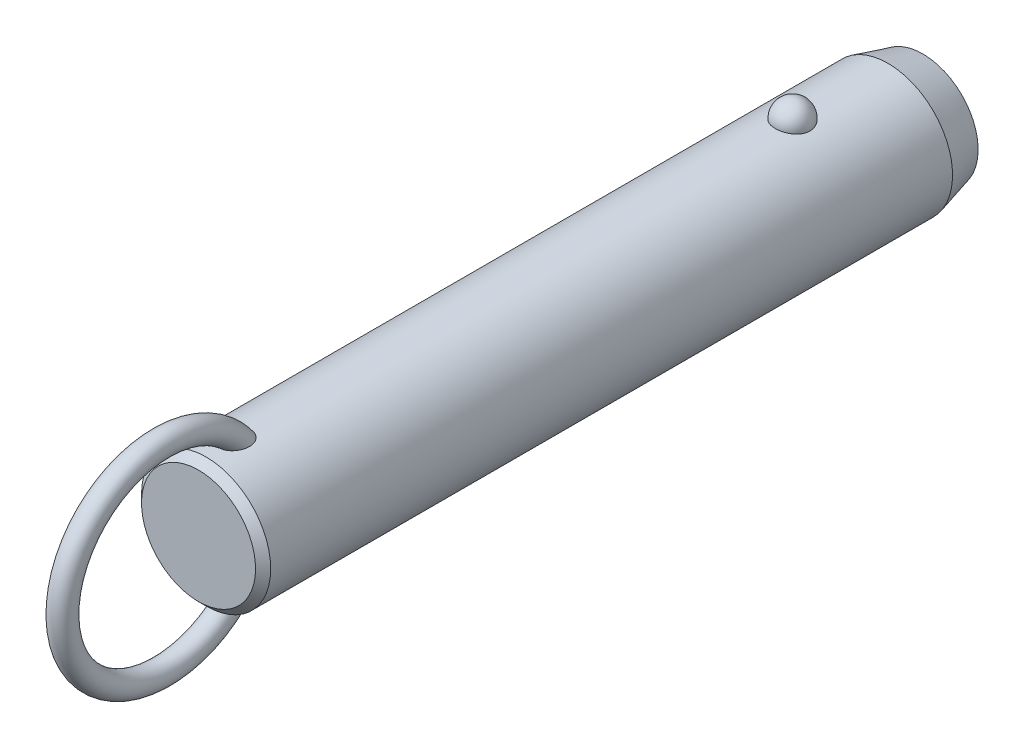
SolidWorks part; units mm, degrees
ref_plane "Front Plane" through (0, 0, 0) normal (0, 0, 1) x (1, 0, 0)
ref_plane "Top Plane" through (0, 0, 0) normal (0, 1, 0) x (1, 0, 0)
ref_plane "Right Plane" through (0, 0, 0) normal (1, 0, 0) x (0, 0, -1)
sketch "Sketch2" plane through (0, 0, 0) normal (0, 0, 1) x (1, 0, 0)
  circle A0 centre (0, 0) radius 11.1
  point P3 (0, 11.1)
  dimension "D1" = 22.2
extrude "Boss-Extrude1" add sketch "Sketch2" along normal blind 86.4
sketch "Sketch3" plane through (0, 0, 0) normal (0, 0, -1) x (-1, 0, 0)
  circle A0 centre (0, 0) radius 11.1
  dimension "D1" = 22.2
extrude "Boss-Extrude2" add sketch "Sketch3" along normal blind 25.4
chamfer "Chamfer1" distance 6 angle 15 1 edges at (-11.1, 0, -25.4)
sketch "Sketch12" plane through (0, 0, 0) normal (1, 0, 0) x (0, 0, -1)
  line L0 (-86.4, 11.1) -> (-86.4, -11.1) construction
  point P0 (-86.4, 0)
sketch "Sketch13" plane through (0, 0, 0) normal (1, 0, 0) x (0, 0, -1)
  circle A0 centre (-105.45, 0) radius 19.05
  point P2 (-86.4, 0)
  dimension "D1" = 38.1
sketch "Sketch14" plane through (0, 0, 0) normal (0, 1, 0) x (1, 0, 0)
  circle A0 centre (0, -88.4) radius 2
  point P2 (0, -86.4)
  dimension "D1" = 4
sweep "Sweep1" add profiles "Sketch14" path "Sketch13"
sketch "Sketch15" plane through (0, 0, 86.4) normal (0, 0, 1) x (1, 0, 0)
  circle A0 centre (0, 0) radius 11.1
  dimension "D1" = 22.2
extrude "Boss-Extrude3" add sketch "Sketch15" along normal blind 12.7
chamfer "Chamfer2" distance 1.3 angle 45 1 edges at (11.1, 0, 99.1)
sketch "Sketch18" plane through (0, 0, 0) normal (1, 0, 0) x (0, 0, -1)
  line L0 (19.4, 11.1) -> (-89.968, 11.1) construction
  line L1 (3, 14.1) -> (3, 8.1)
  line L2 (-89.968, -11.1) -> (19.4, -11.1) construction
  arc A0 (3, 14.1) -> (3, 8.1) centre (3, 11.1) ccw
  point P4 (0, 11.1)
  dimension "D1" = 25.2
revolve "Revolve1" add sketch "Sketch18" angle 360 about L1
